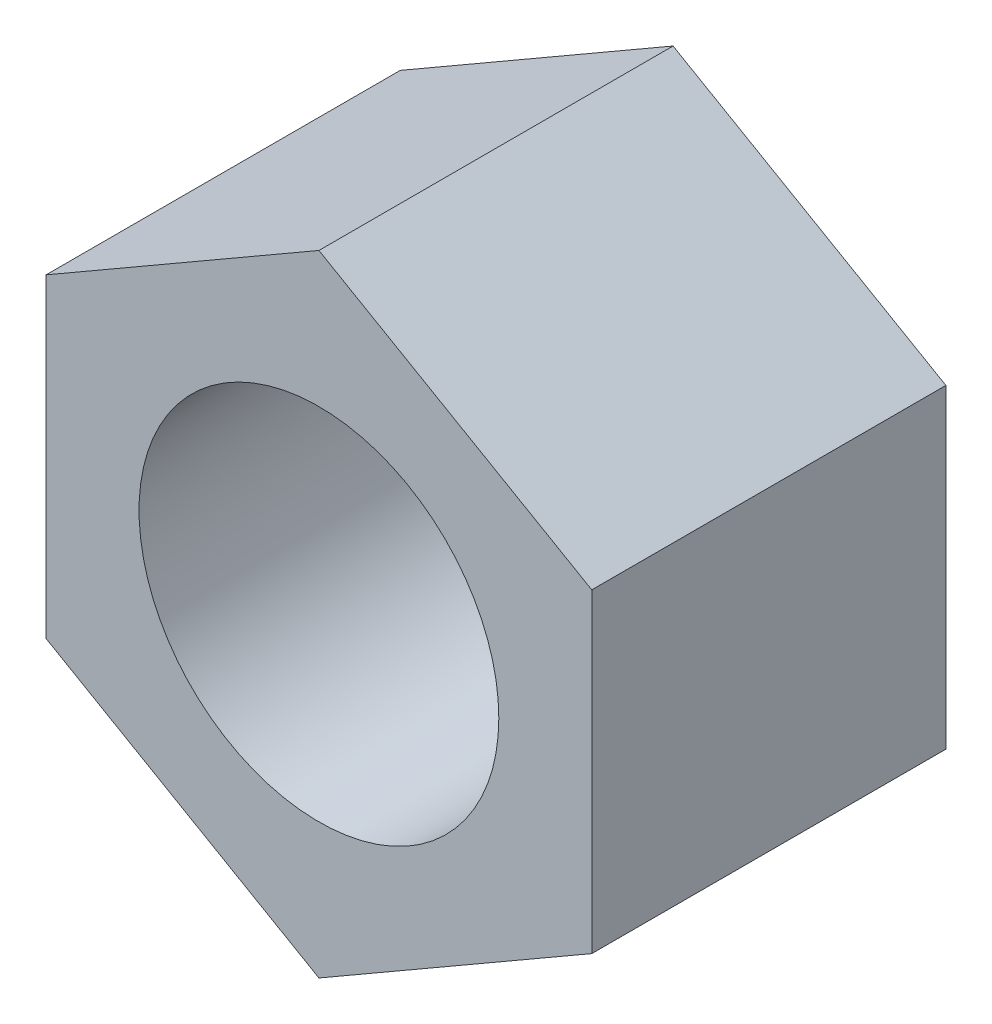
SolidWorks part; units mm, degrees
ref_plane "Front Plane" through (0, 0, 0) normal (1, 0, 0) x (0, 1, 0)
ref_plane "Top Plane" through (0, 0, 0) normal (0, 0, 1) x (0, 1, 0)
ref_plane "Right Plane" through (0, 0, 0) normal (0, 1, 0) x (-1, 0, 0)
sketch "Sketch1" plane through (0, 0, 0) normal (0, 0, 1) x (0, 1, 0)
  line L1 (33.3622, -57.785) -> (66.7244, 0)
  line L2 (66.7244, 0) -> (33.3622, 57.785)
  line L3 (33.3622, 57.785) -> (-33.3622, 57.785)
  line L4 (-33.3622, 57.785) -> (-66.7244, 0)
  line L5 (-66.7244, 0) -> (-33.3622, -57.785)
  line L6 (-33.3622, -57.785) -> (33.3622, -57.785)
  circle A0 centre (0, 0) radius 38.1
  circle A1 centre (0, 0) radius 57.785 construction
  dimension "D1" = 76.2
  dimension "D2" = 115.57
extrude "Nut body" add sketch "Sketch1" along normal blind 75.0062
